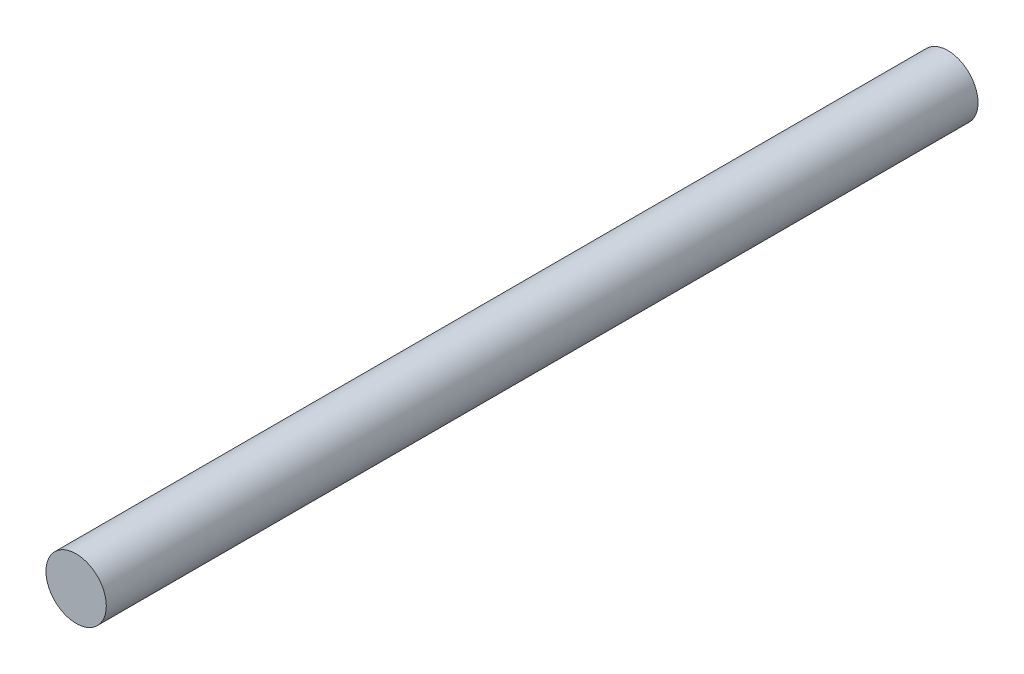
SolidWorks part; units mm, degrees
ref_plane "前视基准面" through (0, 0, 0) normal (0, 0, 1) x (1, 0, 0)
ref_plane "上视基准面" through (0, 0, 0) normal (0, 1, 0) x (1, 0, 0)
ref_plane "右视基准面" through (0, 0, 0) normal (1, 0, 0) x (0, 0, -1)
other "Configuration Table"
sketch "草图1" plane through (0, 0, 0) normal (0, 0, 1) x (1, 0, 0)
  circle A0 centre (0, 0) radius 1.35
  dimension "D1" = 2.7
extrude "凸台-拉伸1" add sketch "草图1" along normal blind 39
